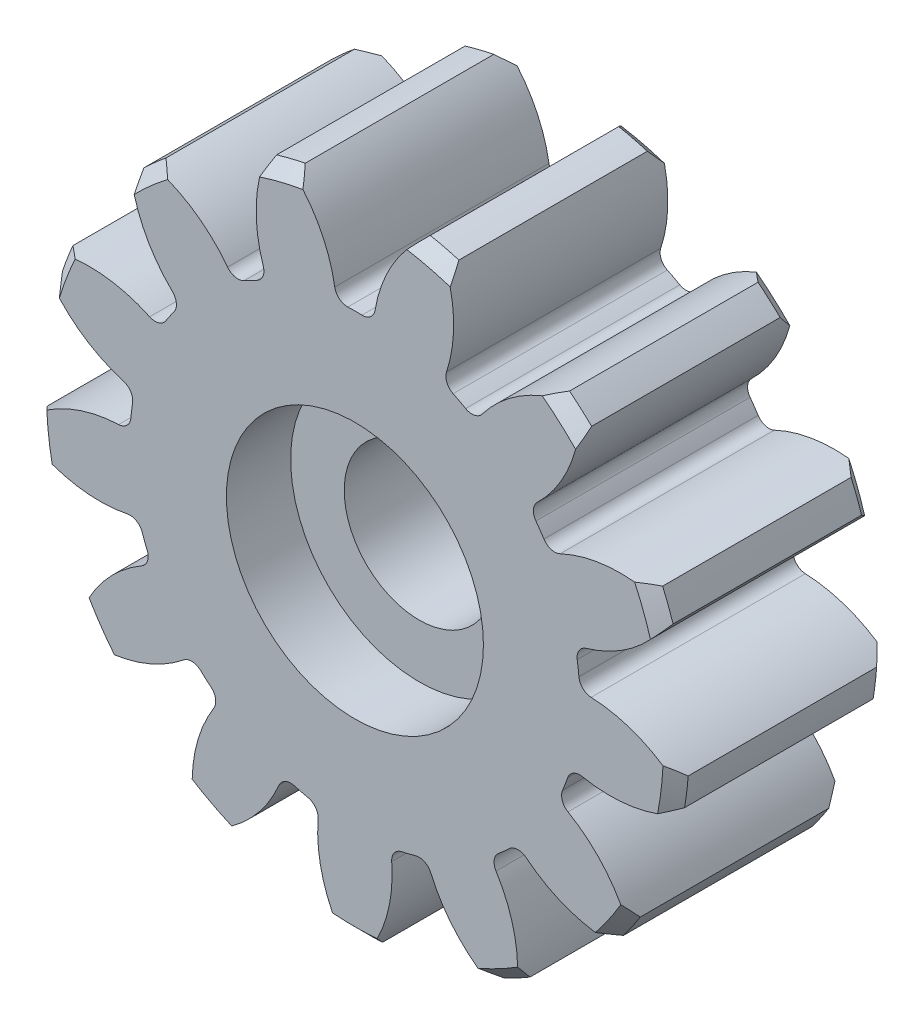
SolidWorks part; units mm, degrees
ref_plane "Front Plane" through (0, 0, 0) normal (0, 0, 1) x (1, 0, 0)
ref_plane "Top Plane" through (0, 0, 0) normal (0, 1, 0) x (1, 0, 0)
ref_plane "Right Plane" through (0, 0, 0) normal (1, 0, 0) x (0, 0, -1)
sketch "Sketch3" plane through (0, 0, 0) normal (0, 0, 1) x (1, 0, 0)
  circle A0 centre (0, 0) radius 15
  circle A1 centre (0, 0) radius 13
  circle A2 centre (0, 0) radius 10.5
extrude "Boss-Extrude1" add sketch "Sketch3" along normal blind 10 contours A0
sketch "Sketch5" plane through (0, 0, 10) normal (0, 0, 1) x (1, 0, 0)
  line L0 (0, -36.3259) -> (0, 39.7899) construction
  line L1 (0, 0) -> (-0.8738, 10.4636) construction
  line L2 (0, 0) -> (0.8738, 10.4636) construction
  line L3 (-1.567, 12.9052) -> (1.567, 12.9052) construction
  line L4 (17.6672, -24.9695) -> (-20.8011, 50.7799) construction
  line L5 (-1.567, 12.9052) -> (11.7342, 19.66) construction
  line L6 (-1.567, 12.9052) -> (13.2894, 14.7091) construction
  line L7 (0, 0) -> (3.5897, 14.5641) construction
  line L8 (1.567, 12.9052) -> (4.6099, 12.1552) construction
  arc A0 (-0.8738, 10.4636) -> (-2.9177, 14.7135) centre (-7.4576, 9.9138) ccw
  circle A1 centre (0, 0) radius 10.5 construction
  circle A2 centre (0, 0) radius 15 construction
  arc A3 (0.8738, 10.4636) -> (2.9177, 14.7135) centre (7.4576, 9.9138) cw
  circle A4 centre (0, 0) radius 13 construction
  arc A5 (-2.9177, 14.7135) -> (2.9177, 14.7135) centre (0, 0) cw
  arc A6 (-0.8738, 10.4636) -> (0.8738, 10.4636) centre (0, 0) cw
  point P14 (-1.567, 12.9052)
  point P15 (1.567, 12.9052)
extrude "Cut-Extrude1" cut sketch "Sketch5" against normal up to surface (10 mm away)
fillet "Fillet1" radius 0.6 2 edges at (0.8738, 10.4636, 5) (-0.8738, 10.4636, 5)
chamfer "Chamfer1" distance 0.6 angle 45 2 edges at (0, -15, 0) (0, -15, 10)
pattern_circular "CirPattern1" count 13 over 360 about axis through (0, 0, 0) along (0, 0, 1) of "Cut-Extrude1", "Fillet1"
sketch "Sketch8" plane through (0, 0, 10) normal (0, 0, 1) x (1, 0, 0)
  circle A0 centre (0, 0) radius 3.5
  dimension "D1" = 7
extrude "Cut-Extrude2" cut sketch "Sketch8" against normal up to surface (10 mm away)
sketch "Sketch9" plane through (0, 0, 10) normal (0, 0, 1) x (1, 0, 0)
  circle A0 centre (0, 0) radius 6
  dimension "D1" = 12
extrude "Cut-Extrude3" cut sketch "Sketch9" against normal blind 3
equation "\"module\"= 2mm"
equation "\"number of teeth\" = 13"
equation "\"pressure angle\"= 20"
equation "\"addendum\"= \"module\""
equation "\"dedendum\"= \"module\" * 1.25"
equation "\"pitch diameter\"= \"number of teeth\" * \"module\""
equation "\"outside diameter\"= \"pitch diameter\" + 2 * \"addendum\""
equation "\"root diameter\"= \"pitch diameter\" - 2 * \"dedendum\""
equation "\"D1@Sketch3\"=\"root diameter\""
equation "\"D2@Sketch3\"=\"pitch diameter\""
equation "\"D3@Sketch3\"=\"outside diameter\""
equation "\"gear thickness\"=10"
equation "\"D1@Boss-Extrude1\"=\"gear thickness\""
equation "\"D1@Sketch5\"=\"pressure angle\""
equation "\"D2@Sketch5\"=180/\"number of teeth\""
equation "\"D1@Fillet1\"=\"module\"*0.3"
equation "\"D1@Chamfer1\"=\"module\"*0.3"
equation "\"D1@CirPattern1\"=\"number of teeth\""
